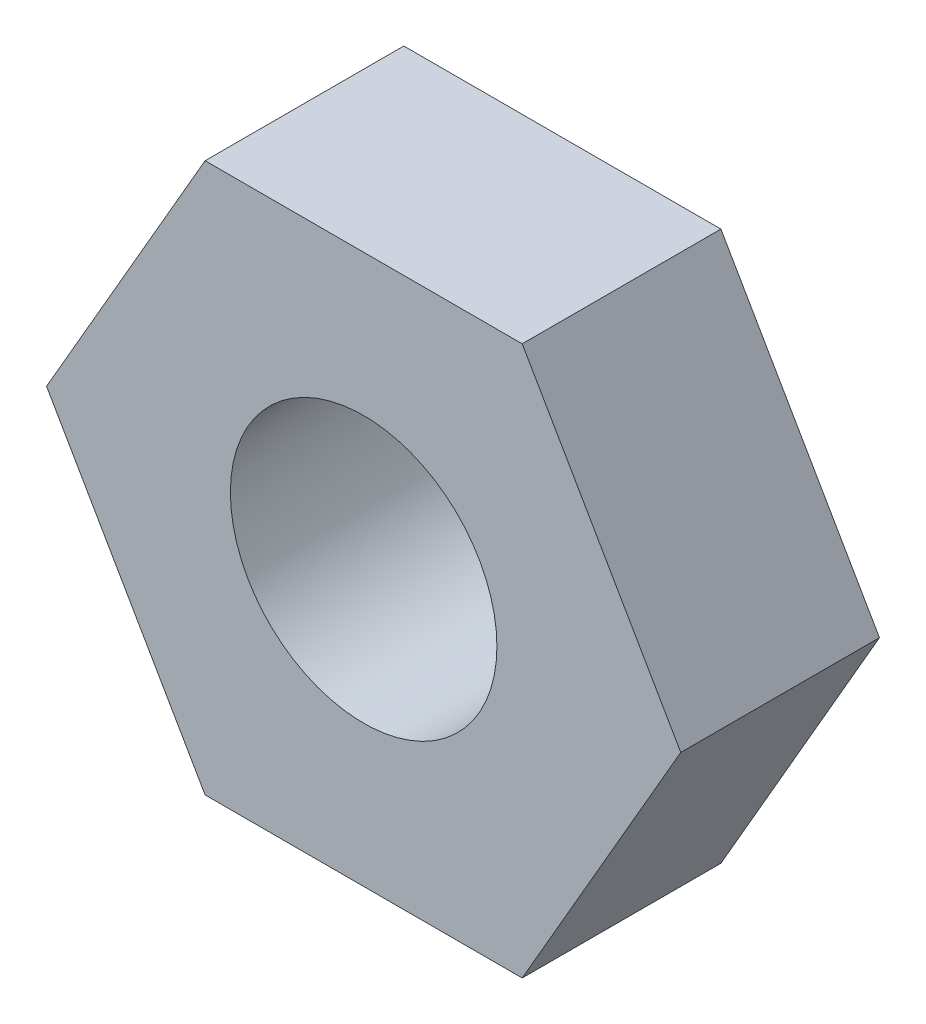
SolidWorks part; units mm, degrees
ref_plane "Front Plane" through (0, 0, 0) normal (0, 0, 1) x (1, 0, 0)
ref_plane "Top Plane" through (0, 0, 0) normal (0, 1, 0) x (1, 0, 0)
ref_plane "Right Plane" through (0, 0, 0) normal (1, 0, 0) x (0, 0, -1)
sketch "Sketch1" plane through (0, 0, 0) normal (0, 0, 1) x (1, 0, 0)
  line L1 (4.986, 0) -> (2.493, 4.318)
  line L2 (2.493, 4.318) -> (-2.493, 4.318)
  line L3 (-2.493, 4.318) -> (-4.986, 0)
  line L4 (-4.986, 0) -> (-2.493, -4.318)
  line L5 (-2.493, -4.318) -> (2.493, -4.318)
  line L6 (2.493, -4.318) -> (4.986, 0)
  circle A0 centre (0, 0) radius 4.318 construction
  dimension "D1" = 8.636
extrude "Boss-Extrude1" add sketch "Sketch1" along normal blind 3.1242
sketch "Sketch2" plane through (0, 0, 3.1242) normal (0, 0, 1) x (1, 0, 0)
  circle A0 centre (0, 0) radius 2.0955
  dimension "D1" = 4.191
extrude "Cut-Extrude1" cut sketch "Sketch2" against normal through all
